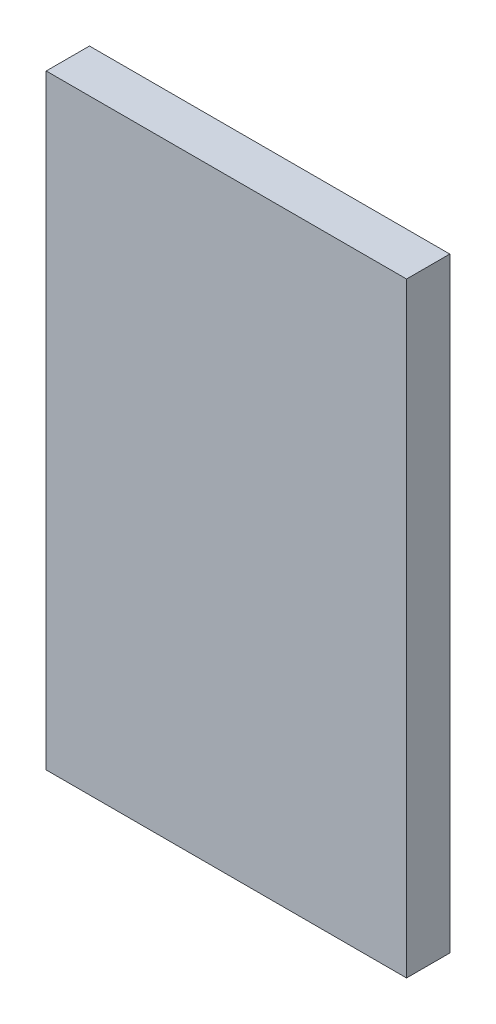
SolidWorks part; units mm, degrees
ref_plane "Front" through (0, 0, 0) normal (0, 0, 1) x (1, 0, 0)
ref_plane "Top" through (0, 0, 0) normal (0, 1, 0) x (1, 0, 0)
ref_plane "Right" through (0, 0, 0) normal (1, 0, 0) x (0, 0, -1)
sketch "Esquisse1" plane through (0, 0, 0) normal (0, 0, 1) x (1, 0, 0)
  line L1 (0, 0) -> (250, 0)
  line L2 (0, 0) -> (0, 420)
  line L3 (0, 420) -> (250, 420)
  line L4 (250, 0) -> (250, 420)
  dimension "D1" = 250
  dimension "D2" = 420
extrude "Boss.-Extru.1" add sketch "Esquisse1" along normal blind 30
